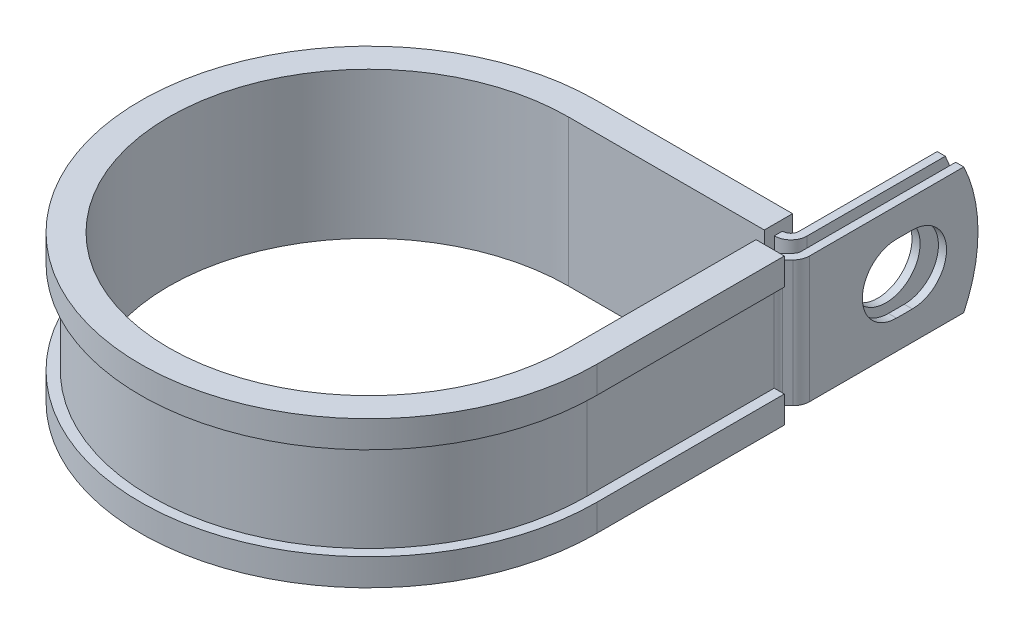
SolidWorks part; units mm, degrees
ref_plane "Front Plane" through (0, 0, 0) normal (0, 0, 1) x (1, 0, 0)
ref_plane "Top Plane" through (0, 0, 0) normal (0, 1, 0) x (1, 0, 0)
ref_plane "Right Plane" through (0, 0, 0) normal (1, 0, 0) x (0, 0, -1)
sketch "Sketch1" plane through (0, 0, 0) normal (0, 1, 0) x (1, 0, 0)
  line L0 (0, 31.6865) -> (29.5708, 31.6865)
  line L1 (31.6865, 0) -> (31.6865, 28.274)
  line L2 (32.0092, 57.1246) -> (32.0092, 34.1249)
  line L3 (32.4007, 29.9982) -> (33.2269, 30.8244)
  line L5 (33.584, 31.6865) -> (33.584, 57.1246)
  arc A0 (0, 31.6865) -> (31.6865, 0) centre (0, 0) ccw
  arc A1 (32.4007, 29.9982) -> (31.6865, 28.274) centre (34.1249, 28.274) ccw
  arc A2 (33.2269, 30.8244) -> (33.584, 31.6865) centre (32.3648, 31.6865) ccw
  arc A3 (29.5708, 31.6865) -> (32.0092, 34.1249) centre (29.5708, 34.1249) ccw
extrude "Extrude-Thin1" add sketch "Sketch1" along normal mid plane 19.05 thin
sketch "Sketch2" plane through (30.79, 0, 0) normal (-1, 0, 0) x (0, 0, 1)
  line L0 (-57.1246, 9.525) -> (-57.1246, -9.525) construction
  line L1 (0, 9.525) -> (0, -9.525) construction
  circle A0 centre (-46.0248, 0) radius 5.1562
  point P2 (-57.1246, 0)
extrude "Cut-Extrude1" cut sketch "Sketch2" against normal up to surface (1.2192 mm away)
sketch "Sketch3" plane through (34.8032, 0, 0) normal (1, 0, 0) x (0, 0, -1)
  line L0 (44.831, 0) -> (47.2186, 0) construction
  line L1 (44.831, 5.1562) -> (47.2186, 5.1562)
  line L2 (44.831, -5.1562) -> (47.2186, -5.1562)
  line L3 (57.1246, 9.525) -> (57.1246, -9.525) construction
  arc A0 (44.831, 5.1562) -> (44.831, -5.1562) centre (44.831, 0) ccw
  arc A1 (47.2186, -5.1562) -> (47.2186, 5.1562) centre (47.2186, 0) ccw
  point P3 (46.0248, 0)
  point P8 (57.1246, 0)
  point P11 (39.6748, 0)
  point P12 (52.3748, 0)
extrude "Cut-Extrude2" cut sketch "Sketch3" against normal up to surface (1.2192 mm away)
sketch "Sketch4" plane through (30.79, 0, 0) normal (-1, 0, 0) x (0, 0, 1)
  line L0 (-57.1246, 9.525) -> (-57.1246, -9.525)
  line L1 (-57.1246, 9.525) -> (-54.9801, 9.525)
  line L2 (-57.1246, 9.525) -> (-34.1249, 9.525) construction
  line L3 (-57.1246, -9.525) -> (-54.9801, -9.525)
  line L4 (-57.1246, -9.525) -> (-34.1249, -9.525) construction
  arc A0 (-54.9801, 9.525) -> (-54.9801, -9.525) centre (-34.8996, 0) ccw
extrude "Cut-Extrude3" cut sketch "Sketch4" against normal through all contours A0 M4 M5 | A0 L0 M2
ref_plane "Plane1" through (0, 0, -28.274) normal (0, 0, -1) x (-1, 0, 0)
ref_plane "Plane2" through (29.52, 0, 0) normal (-1, 0, 0) x (0, 0, 1)
sketch "Sketch5" plane through (0, 0, -28.274) normal (0, 0, -1) x (-1, 0, 0)
  line L0 (-32.9057, 9.525) -> (-31.6865, 9.525)
  line L1 (-32.9057, 9.525) -> (-32.9057, -9.525) construction
  line L3 (-31.6865, 9.525) -> (-31.6865, -9.525)
  line L4 (-31.6865, -9.525) -> (-32.9057, -9.525)
  line L5 (-32.9057, -9.525) -> (-32.9057, -6.985)
  line L6 (-32.9057, 9.525) -> (-32.9057, 6.985)
  line L7 (-34.4297, 11.049) -> (-34.4297, 6.985)
  line L8 (-34.4297, 11.049) -> (-30.1625, 11.049)
  line L9 (-30.1625, 11.049) -> (-30.1625, -11.049)
  line L10 (-30.1625, -11.049) -> (-34.4297, -11.049)
  line L11 (-34.4297, -11.049) -> (-34.4297, -6.985)
  line L12 (-34.4297, 6.985) -> (-32.9057, 6.985)
  line L13 (-32.9057, -6.985) -> (-34.4297, -6.985)
sketch "Sketch6" plane through (0, 9.525, 0) normal (0, 1, 0) x (1, 0, 0)
  line L0 (30.1625, 0) -> (30.1625, 28.274)
  line L1 (30.1625, 28.274) -> (34.4297, 28.274) construction
  line L2 (29.52, 6.9878) -> (29.52, -6.9878) construction
  line L5 (0, 30.1625) -> (29.52, 30.1625)
  arc A0 (0, 30.1625) -> (30.1625, 0) centre (0, 0) ccw
sweep "Sweep1" add profiles "Sketch5" path "Sketch6"
equation "\"D4@Sketch5\" = \"D1@Extrude-Thin1\""
equation "\"D5@Sketch5\" = \"D5@Extrude-Thin1\""
equation "\"D1@Sketch3\" = \"D2@Sketch2\""
equation "\"D7@Sketch1\" = \"D3@Sketch2\" + \"D1@Sketch3\""
equation "\"D1@Sketch1\" = \"D1@Sketch6\" + 2 * \"D3@Sketch5\""
equation "\"D1@Sketch4\" = ( \"D1@Extrude-Thin1\" + .125 ) * 2"
equation "\"D9@Sketch1\"= \"D5@Extrude-Thin1\""
equation "\"D8@Sketch1\"= 2 * \"D5@Extrude-Thin1\""
equation "\"D2@Sketch1\" = 2 * \"D5@Extrude-Thin1\""
equation "\"D2@Sketch3\" = \"D1@Sketch2\""
